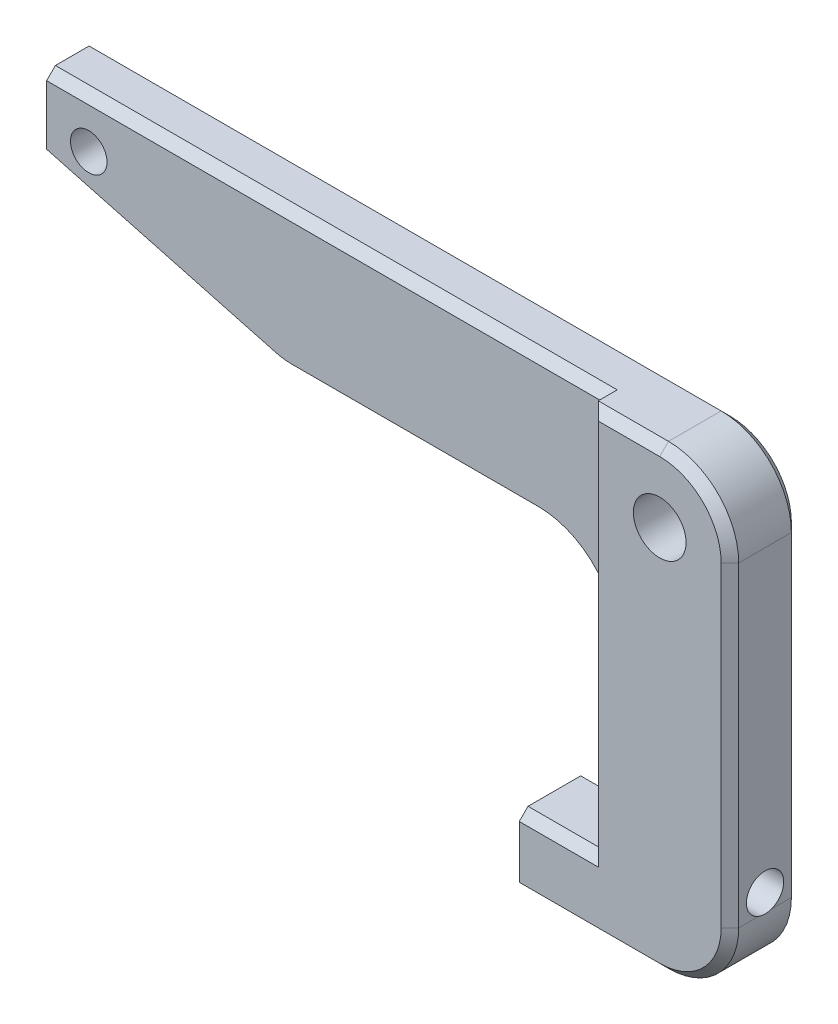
SolidWorks part; units mm, degrees
ref_plane "Plane1" through (0, 0, 0) normal (0, 0, 1) x (1, 0, 0)
ref_plane "Plane2" through (0, 0, 0) normal (0, 1, 0) x (1, 0, 0)
ref_plane "Plane3" through (0, 0, 0) normal (1, 0, 0) x (0, 0, -1)
sketch "Sketch1" plane through (0, 0, 0) normal (0, 0, 1) x (1, 0, 0)
  line L0 (-114.3, 12.7) -> (-114.3, -12.7)
  line L1 (-114.3, -12.7) -> (-12.7, -12.7)
  line L2 (12.7, 12.7) -> (-114.3, 12.7)
  line L3 (12.7, 12.7) -> (12.7, -69.85)
  line L4 (-12.7, -12.7) -> (-12.7, -57.15)
  line L5 (12.7, -69.85) -> (-25.4, -69.85)
  line L6 (-25.4, -69.85) -> (-25.4, -57.15)
  line L7 (-25.4, -57.15) -> (-12.7, -57.15)
  dimension "D1" = 82.55
  dimension "D2" = 127
  dimension "D3" = 44.45
  dimension "D4" = 25.4
  dimension "D5" = 12.7
  dimension "D6" = 12.7
  dimension "D7" = 25.4
  dimension "D8" = 38.1
extrude "Base-Extrude" add sketch "Sketch1" along normal blind 12.7
sketch "Sketch2" plane through (0, 0, 12.7) normal (0, 0, 1) x (1, 0, 0)
  circle A0 centre (0, 0) radius 4.7625
  dimension "D1" = 9.525
extrude "Cut-Extrude1" cut sketch "Sketch2" against normal through all
sketch "Sketch3" plane through (-40.8261, 4.3037, 12.7) normal (0, 0, 1) x (1, 0, 0)
  line L0 (-73.4739, 8.3963) -> (-73.4739, -17.0037) construction
  line L1 (53.5261, 8.3963) -> (-73.4739, 8.3963) construction
  circle A0 centre (-65.8539, -0.4937) radius 3.302
  dimension "D1" = 6.604
  dimension "D2" = 7.62
  dimension "D3" = 8.89
extrude "Cut-Extrude2" cut sketch "Sketch3" against normal through all
chamfer "Chamfer1" distance 11.43 angle 75 1 edges at (-114.3, -12.7, 6.35)
sketch "Sketch5" plane through (-65.558, -0.2007, 12.7) normal (0, 0, 1) x (1, 0, 0)
  line L0 (52.858, 12.9007) -> (-48.742, 12.9007)
  line L1 (52.858, 12.9007) -> (52.858, -12.4993)
  line L2 (-48.742, -12.4993) -> (52.858, -12.4993)
  line L3 (-48.742, -12.4993) -> (-48.742, 12.9007)
  line L4 (-48.742, 12.9007) -> (-48.742, -1.0693) construction
  line L5 (78.258, 12.9007) -> (-48.742, 12.9007) construction
  line L6 (52.858, -12.4993) -> (52.858, -56.9493) construction
  line L7 (-6.0847, -12.4993) -> (52.858, -12.4993) construction
extrude "Cut-Extrude4" cut sketch "Sketch5" against normal blind 3.429
hole_wizard "Hole1" positions "Sketch6" profile "Sketch7" legacy
sketch "Sketch6" plane through (12.7, 0, 0) normal (1, 0, 0) x (0, 0, -1)
  line L0 (-6.35, -53.975) -> (-6.35, 12.7) construction
  line L1 (-12.7, 12.7) -> (0, 12.7) construction
  line L2 (0, 0) -> (-12.7, 0) construction
  point P0 (-6.35, -53.975)
  dimension "D1" = 53.975
sketch "Sketch7" plane through (12.7, -53.975, 6.35) normal (0, 1, 0) x (0, 0, -1)
  line L0 (0, 0) -> (0, 127)
  line L1 (0, 127) -> (2.1082, 127)
  line L2 (2.1082, 127) -> (2.1082, 126.9975)
  line L3 (2.1082, 126.9975) -> (2.1082, 12.7)
  line L4 (2.1082, 12.7) -> (2.7407, 12.7)
  line L5 (2.7407, 12.7) -> (3.3731, 12.7)
  line L6 (3.3731, 12.7) -> (3.3731, 6.35)
  line L7 (3.3731, 6.35) -> (3.3731, 0)
  line L8 (3.3731, 0) -> (0, 0)
fillet "Fillet2" radius 12.7 4 edges at (12.7, 12.7, 6.35) (12.7, -69.85, 6.35) (-71.6427, -12.7, 4.6355) (-12.7, -12.7, 4.6355)
chamfer "Chamfer2" distance 1.5875 angle 45 5 edges at (-57.15, 12.7, 0) (12.7, -28.575, 0) (-12.7, -69.85, 0) (8.9803, -66.1303, 0) (8.9803, 8.9803, 0)
chamfer "Chamfer3" distance 1.5875 angle 45 18 edges at (-93.7788, -6.7686, 0) (-71.6284, -12.5913, 0) (-47.6853, -12.7, 0) (-16.4197, -16.4197, 0) (-19.05, -57.15, 0) (-12.7, -41.275, 0) (-6.35, 12.7, 12.7) (-16.4197, -16.4197, 9.271) (8.9803, 8.9803, 12.7) (-47.6853, -12.7, 9.271) (-12.7, -69.85, 12.7) (12.7, -28.575, 12.7) (-71.6284, -12.5913, 9.271) (8.9803, -66.1303, 12.7) (-63.5, 12.7, 9.271) (-93.7788, -6.7686, 9.271) (-19.05, -57.15, 12.7) (-12.7, -22.225, 12.7)
sketch "Sketch8" plane through (0, 0, 0) normal (0, 0, -1) x (-1, 0, 0)
  circle A0 centre (0, 0) radius 9.525
  dimension "D1" = 19.05
extrude "Cut-Extrude5" cut sketch "Sketch8" against normal blind 4.7752
